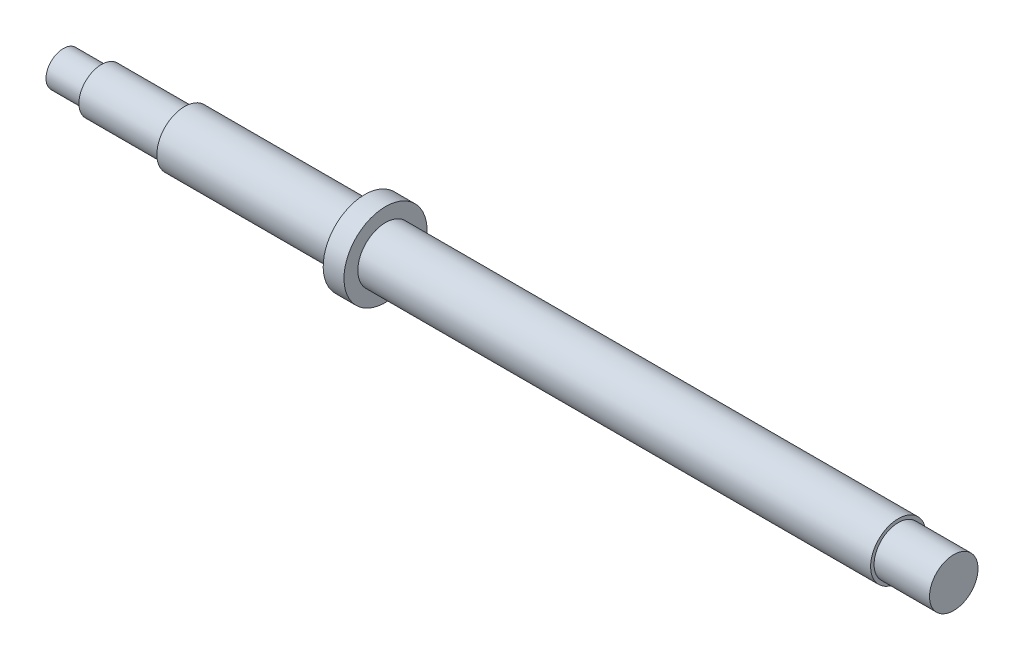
SolidWorks part; units mm, degrees
ref_plane "Front Plane" through (0, 0, 0) normal (0, 0, 1) x (1, 0, 0)
ref_plane "Top Plane" through (0, 0, 0) normal (0, 1, 0) x (1, 0, 0)
ref_plane "Right Plane" through (0, 0, 0) normal (1, 0, 0) x (0, 0, -1)
sketch "Sketch2" plane through (0, 0, 0) normal (0, 0, 1) x (1, 0, 0)
  line L0 (0, 0) -> (0, 5)
  line L1 (0, 5) -> (11, 5)
  line L2 (11, 5) -> (11, 6.5)
  line L3 (11, 6.5) -> (35, 6.5)
  line L4 (35, 6.5) -> (35, 8)
  line L5 (35, 8) -> (87, 8)
  line L6 (87, 8) -> (87, 12)
  line L7 (87, 12) -> (93, 12)
  line L8 (93, 12) -> (93, 8)
  line L9 (93, 8) -> (241, 8)
  line L10 (241, 8) -> (241, 7)
  line L11 (241, 7) -> (257, 7)
  line L12 (257, 7) -> (257, 0)
  line L13 (257, 0) -> (0, 0)
  dimension "D1" = 5
  dimension "D2" = 11
  dimension "D3" = 1.5
  dimension "D4" = 24
  dimension "D5" = 1.5
  dimension "D6" = 52
  dimension "D7" = 4
  dimension "D8" = 6
  dimension "D9" = 148
  dimension "D10" = 1
  dimension "D11" = 16
  dimension "D12" = 4
  dimension "D13" = 7
revolve "Revolve1" add sketch "Sketch2" angle 360 about L13
